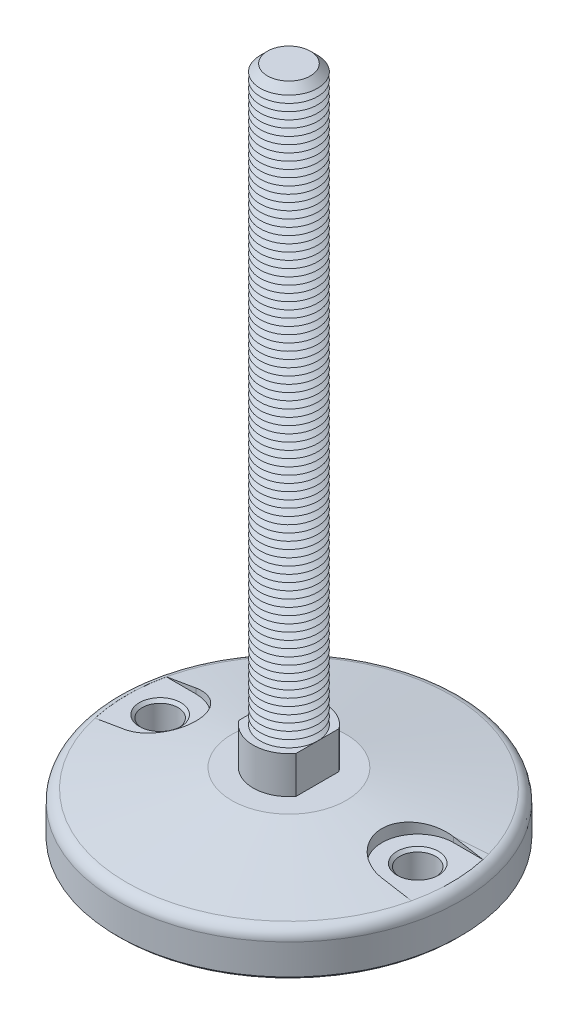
SolidWorks part; units mm, degrees
ref_plane "Front Plane" through (0, 0, 0) normal (0, 0, 1) x (1, 0, 0)
ref_plane "Top Plane" through (0, 0, 0) normal (0, 1, 0) x (1, 0, 0)
ref_plane "Right Plane" through (0, 0, 0) normal (1, 0, 0) x (0, 0, -1)
sketch "Sketch1" plane through (0, 0, 0) normal (1, 0, 0) x (0, 0, -1)
  line L0 (0, 61.3389) -> (0, -58.404) construction
sketch "Sketch2" plane through (0, 0, 0) normal (1, 0, 0) x (0, 0, -1)
  line L0 (0, 0) -> (-20, 0)
  line L1 (-20, 0) -> (-60, -7.0531)
  line L2 (-60, -7.0531) -> (-60, -22)
  line L3 (-60, -22) -> (0, -22)
  line L4 (0, 61.3389) -> (0, -58.404) construction
  line L5 (0, -22) -> (0, 0)
  dimension "D1" = 22
  dimension "D2" = 60
  dimension "D3" = 20
  dimension "D4" = 10
revolve "Revolve1" add sketch "Sketch2" angle 360 about L0
fillet "Fillet1" radius 4 1 edges at (0, -7.0531, 60)
sketch "Sketch3" plane through (0, 0, 0) normal (0, 1, 0) x (1, 0, 0)
  circle A0 centre (0, 0) radius 12.5
  dimension "D1" = 25
extrude "Boss-Extrude1" add sketch "Sketch3" along normal blind 13
sketch "Sketch4" plane through (0, 13, 0) normal (0, 1, 0) x (1, 0, 0)
  line L0 (-10, 7.5) -> (-10, -7.5)
  line L2 (10, -7.5) -> (10, 7.5)
  arc A0 (-10, 7.5) -> (-10, -7.5) centre (0, 0) ccw
  circle A1 centre (0, 0) radius 12.5 construction
  arc A2 (10, -7.5) -> (10, 7.5) centre (0, 0) ccw
  dimension "D1" = 20
extrude "Cut-Extrude1" cut sketch "Sketch4" against normal blind 13
sketch "Sketch5" plane through (0, 13, 0) normal (0, 1, 0) x (1, 0, 0)
  circle A0 centre (0, 0) radius 10
  dimension "D1" = 20
extrude "Boss-Extrude2" add sketch "Sketch5" along normal blind 200
chamfer "Chamfer1" distance 2.5 angle 45 1 edges at (0, 213, 10)
sketch "Sketch6" plane through (0, 0, 0) normal (1, 0, 0) x (0, 0, -1)
  line L0 (-10, 13) -> (-7.8349, 14.25)
  line L1 (-7.8349, 14.25) -> (-10, 15.5)
  line L2 (-10, 210.5) -> (-10, 13) construction
  line L3 (-10, 15.5) -> (-10, 13)
  dimension "D1" = 2.5
revolve "Cut-Revolve1" cut sketch "Sketch6" angle 360 about L0
pattern_linear "LPattern1" count 79 spacing 2.5 along (0, 1, 0) of "Cut-Revolve1"
sketch "Sketch8" plane through (0, 0, 0) normal (0, 1, 0) x (1, 0, 0)
  line L0 (-45, 12.5) -> (-55.2994, 12.5)
  line L1 (-45, -12.5) -> (-55.2994, -12.5)
  arc A1 (-55.2994, 12.5) -> (-55.2994, -12.5) centre (0, 0) ccw
  circle A2 centre (0, 0) radius 56.6946 construction
  arc A3 (-45, -12.5) -> (-45, 12.5) centre (-45, 0) ccw
  point P3 (-45, 0)
  point P11 (0, 0)
  dimension "D1" = 45
  dimension "D2" = 25
extrude "Cut-Extrude4" cut sketch "Sketch8" against normal blind 6.5
sketch "Sketch10" plane through (0, -6.5, 0) normal (0, 1, 0) x (1, 0, 0)
  circle A0 centre (-45, 0) radius 6.25
  dimension "D1" = 12.5
extrude "Cut-Extrude5" cut sketch "Sketch10" against normal up to surface (15.5 mm away)
chamfer "Chamfer2" distance 1 angle 45 2 edges at (-45, -22, -6.25) (-45, -6.5, 6.25)
mirror "Mirror1" about plane through (0, 0, 0) normal (1, 0, 0) of "Chamfer2", "Cut-Extrude5", "Cut-Extrude4"
chamfer "Chamfer3" distance 1 angle 45 1 edges at (0, -22, 60)
